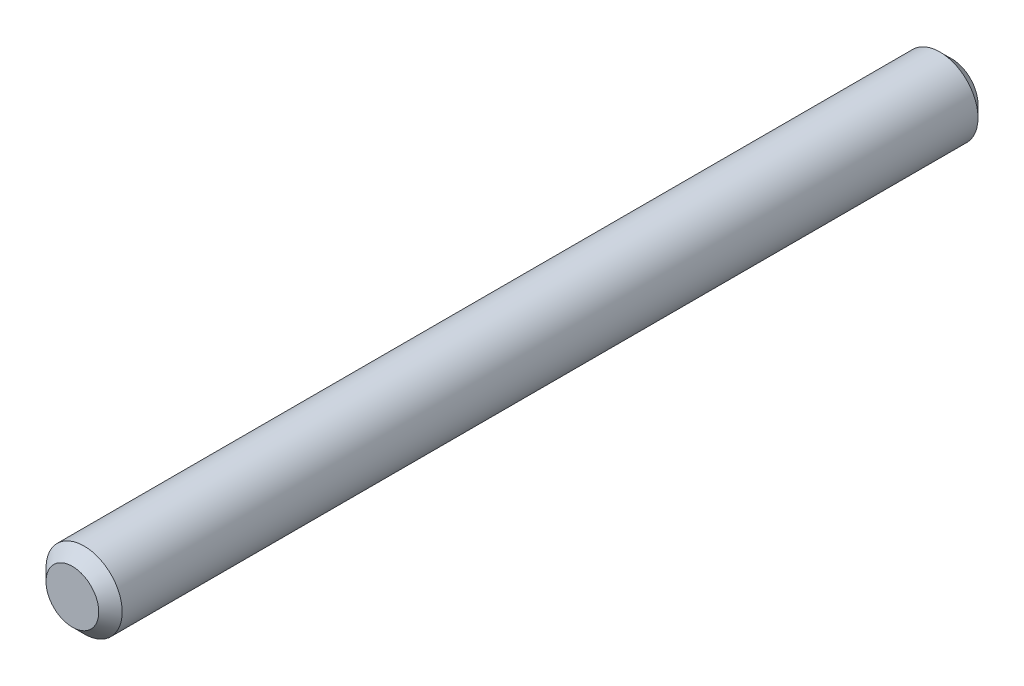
SolidWorks part; units mm, degrees
ref_plane "FACE" through (0, 0, 0) normal (0, 0, 1) x (1, 0, 0)
ref_plane "DESSUS" through (0, 0, 0) normal (0, 1, 0) x (1, 0, 0)
ref_plane "GAUCHE" through (0, 0, 0) normal (1, 0, 0) x (0, 0, -1)
sketch "Esquisse1" plane through (0, 0, 0) normal (0, 0, 1) x (1, 0, 0)
  circle A0 centre (0, 0) radius 0.65
  dimension "D1" = 1.3
extrude "Base-Extrusion" add sketch "Esquisse1" along normal blind 15
chamfer "Chanfrein1" distance 0.2 angle 45
